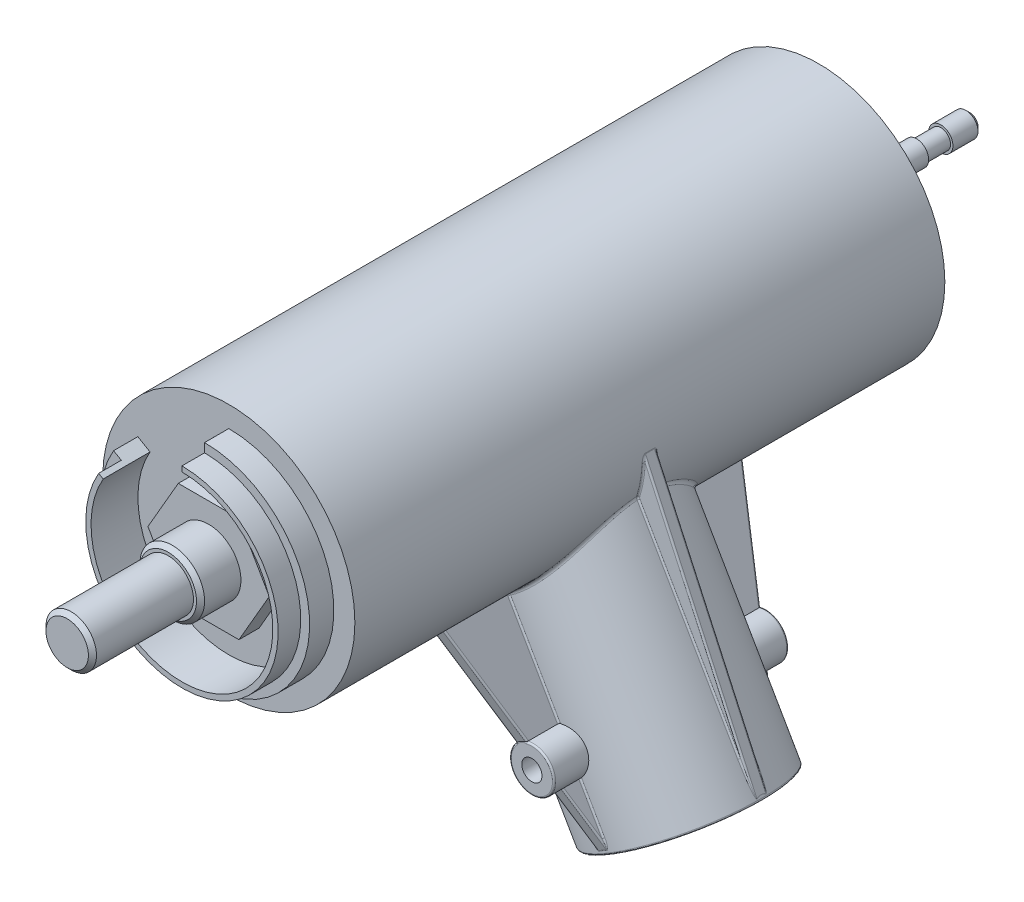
SolidWorks part; units mm, degrees
ref_plane "Plan de face" through (0, 0, 0) normal (0, 0, 1) x (1, 0, 0)
ref_plane "Plan de dessus" through (0, 0, 0) normal (0, 1, 0) x (1, 0, 0)
ref_plane "Plan de droite" through (0, 0, 0) normal (1, 0, 0) x (0, 0, -1)
sketch "Esquisse1" plane through (0, 0, 0) normal (0, 0, 1) x (1, 0, 0)
  circle A0 centre (0, 0) radius 15.6
  dimension "D1" = 31.2
extrude "Extrusion1" add sketch "Esquisse1" along normal mid plane 73
sketch "Esquisse2" plane through (0, 0, 0) normal (1, 0, 0) x (0, 0, -1)
  line L0 (-36.5, 11.25) -> (-36.5, 13)
  line L1 (-36.5, 13) -> (-39.5, 13)
  line L2 (-39.5, 13) -> (-39.5, 11.9)
  line L3 (-39.5, 11.9) -> (-42.3, 11.9)
  line L4 (-42.3, 11.9) -> (-42.3, 11.25)
  line L5 (-42.3, 11.25) -> (-36.5, 11.25)
  line L6 (-36.5, 15.6) -> (-36.5, -15.6) construction
  dimension "D1" = 13
  dimension "D2" = 11.9
  dimension "D3" = 11.25
  dimension "D4" = 5.8
  dimension "D5" = 3
revolve "Révolution1" add sketch "Esquisse2" angle 300 about axis through (0, 0, 36.5) along (0, 0, -1)
ref_plane "Plan1" through (0, 0, 0) normal (0.866, 0.5, 0) x (0, 0, -1)
ref_plane "Plan2" through (0, 0, 0) normal (0.5, -0.866, 0) x (0.866, 0.5, 0)
sketch "Esquisse3" plane through (0, 0, 0) normal (0.5, -0.866, 0) x (0.866, 0.5, 0)
  circle A0 centre (0, 0) radius 10.5
  dimension "D1" = 21
extrude "Extrusion2" add sketch "Esquisse3" along normal blind 41
sketch "Esquisse4" plane through (0, 0, 0) normal (0.866, 0.5, 0) x (0, 0, -1)
  line L0 (-21.6649, -6.1379) -> (-10.5, -40.5)
  line L2 (-10.5, -15.6) -> (-10.5, -41) construction
  dimension "D1" = 18
  dimension "D2" = 0.5
rib "Nervure8" sketch "Esquisse4" sketch "Esquisse4" thickness 1.5 extrusion direction parallel to sketch draft on no parameters "D1"=1.5
mirror "Symétrie1" about plane through (0, 0, 0) normal (0, 0, 1) of "Nervure8"
sketch "Esquisse5" plane through (0, 0, 0) normal (0, 0, 1) x (1, 0, 0)
  line L0 (14.3867, 2.7963) -> (29.3433, -29.824)
  line L1 (29.5933, -30.257) -> (14.8619, -4.7416) construction
  dimension "D1" = 0.5
rib "Nervure9" sketch "Esquisse5" sketch "Esquisse5" thickness 1.5 extrusion direction parallel to sketch draft on no parameters "D1"=1.5
mirror "Symétrie2" about plane through (0, 0, 0) normal (0.866, 0.5, 0) of "Nervure9"
fillet "Congé1" radius 0.2 33 edges at (11.1567, -40.324, 0) (-7.9311, -13.4335, 0) (15.5993, 0.1518, 0) (29.3433, -29.824, 0) (7.8, -13.51, -18.5905) (20.25, -35.074, -10.5) (20.25, -35.074, 10.5) (7.8, -13.51, 18.5905) (-5.6831, -14.528, 0.75) (4.0167, -27.9035, 0.75) (1.6958, -26.9956, 0.75) (4.0167, -27.9035, -0.75) (-5.6831, -14.528, -0.75) (1.6958, -26.9956, -0.75) (22.531, -14.9664, -0.75) (15.4232, -2.3423, -0.75) (22.1568, -17.4304, -0.75) (15.4232, -2.3423, 0.75) (22.531, -14.9664, 0.75) (22.1568, -17.4304, 0.75) (13.3916, -24.6949, 10.4732) (7.1415, -13.8694, 14.5348) (13.3916, -24.6949, 14.5348) (13.3916, -24.6949, -14.5348) (7.1415, -13.8694, -14.5348) (13.3916, -24.6949, -10.4732) (29.5933, -30.257, 0) (14.6906, -23.9449, -14.5348) (14.6906, -23.9449, -10.4732) (8.4405, -13.1194, -14.5348) (14.6906, -23.9449, 10.4732) (14.6906, -23.9449, 14.5348) (8.4405, -13.1194, 14.5348)
sketch "Esquisse8" plane through (0, 0, 0) normal (0, 0, 1) x (1, 0, 0)
  line L0 (11.5799, -40.657) -> (29.4201, -30.357) construction
  line L1 (8.5352, -13.2834) -> (20.3332, -33.7181) construction
  circle A0 centre (15.5, -26.8468) radius 2.75
  dimension "D1" = 5.5
  dimension "D2" = 10
  dimension "D3" = 0.75
extrude "Extrusion8" add sketch "Esquisse8" along normal mid plane 29
fillet "Congé2" radius 0.2 2 edges at (18.25, -26.8468, 14.5) (18.25, -26.8468, -14.5)
sketch "Esquisse9" plane through (0, 0, -14.5) normal (0, 0, -1) x (-1, 0, 0)
  circle A0 centre (-15.5, -26.8468) radius 1.25
  dimension "D1" = 2.5
extrude "Enlèv. mat.-Extru.2" cut sketch "Esquisse9" against normal through all
sketch "Esquisse7" plane through (20.5, -35.507, 0) normal (0.5, -0.866, 0) x (0.866, 0.5, 0)
  circle A0 centre (0, 0) radius 8
  dimension "D1" = 16
extrude "Enlèv. mat.-Extru.1" cut sketch "Esquisse7" against normal blind 35
fillet "Congé3" radius 0.5 12 edges at (-3.3007, -15.2974, -0.8184) (7.1233, -13.9428, -10.5227) (7.1233, -13.9428, 10.5227) (-3.3007, -15.2974, 0.8184) (14.8983, -4.7902, 0.8184) (8.5131, -13.1403, 10.5227) (8.5131, -13.1403, -10.5227) (14.8983, -4.7902, -0.8184) (13.4668, -7.8744, 7.1111) (13.4539, -7.8964, -7.1351) (13.4668, -7.8744, 7.1111) (11.9093, -10.0761, -9.0784)
sketch "Esquisse10" plane through (0, 0, -36.5) normal (0, 0, -1) x (-1, 0, 0)
  circle A0 centre (0, 0) radius 14.2
  dimension "D1" = 28.4
extrude "Enlèv. mat.-Extru.3" cut sketch "Esquisse10" against normal blind 5.3
sketch "Esquisse11" plane through (0, 0, -31.2) normal (0, 0, -1) x (-1, 0, 0)
  circle A0 centre (0, 0) radius 12.5
  dimension "D1" = 25
extrude "Enlèv. mat.-Extru.4" cut sketch "Esquisse11" against normal blind 1
sketch "Esquisse12" plane through (0, 0, -30.2) normal (0, 0, -1) x (-1, 0, 0)
  circle A0 centre (0, 0) radius 3
  circle A1 centre (0, 0) radius 1.5
  dimension "D1" = 6
  dimension "D2" = 3
extrude "Extrusion9" add sketch "Esquisse12" along normal blind 5
sketch "Esquisse14" plane through (0, 0, 0) normal (0, 1, 0) x (1, 0, 0)
  line L0 (1.5, 35.2) -> (-1.5, 35.2) construction
  line L1 (0, 35.2) -> (-1.5, 35.2)
  line L2 (0, 35.2) -> (0, 55.2)
  line L3 (0, 55.2) -> (-1, 55.2)
  line L4 (-1.5, 35.2) -> (-1.5, 48.6)
  line L5 (-1, 55.2) -> (-1.5, 54.7)
  line L6 (-1.5, 51.6) -> (-1.2, 51.6)
  line L7 (-1.2, 51.6) -> (-1.2, 48.6)
  line L8 (-1.2, 48.6) -> (-1.5, 48.6)
  line L9 (-1.5, 51.6) -> (-1.5, 54.7)
  point P1 (-1.5, 55.2)
  dimension "D1" = 20
  dimension "D2" = 1.5
  dimension "D3" = 1.2
  dimension "D4" = 3.6
  dimension "D6" = 3
revolve "Révolution2" add sketch "Esquisse14" angle 360 about L2
sketch "Esquisse15" plane through (0, 0, 0) normal (0, 1, 0) x (1, 0, 0)
  line L0 (0, -36.5) -> (-4, -36.5)
  line L1 (-4, -36.5) -> (-4, -43.5)
  line L2 (-3.5, -44) -> (-3.125, -44)
  line L3 (-3.125, -44) -> (-3.125, -56)
  line L4 (-2.625, -56.5) -> (0, -56.5)
  line L5 (0, -56.5) -> (0, -36.5)
  line L6 (-11.25, -36.5) -> (11.25, -36.5) construction
  line L7 (0, 31.2) -> (0, 36.5) construction
  line L8 (-3.125, -56) -> (-2.625, -56.5)
  line L9 (-4, -43.5) -> (-3.5, -44)
  point P3 (-4, -44)
  point P5 (-3.125, -56.5)
  dimension "D1" = 3.125
  dimension "D2" = 20
  dimension "D3" = 4
  dimension "D4" = 12.5
revolve "Révolution3" add sketch "Esquisse15" angle 360 about L5
sketch "Esquisse16" plane through (0, 0, 36.5) normal (0, 0, 1) x (1, 0, 0)
  line L0 (24.8291, 0) -> (-24.8291, 0) construction
  line L1 (3.7528, 6.5) -> (-3.7528, 6.5)
  line L2 (-3.7528, 6.5) -> (-7.5056, 0)
  line L3 (-7.5056, 0) -> (-3.7528, -6.5)
  line L4 (-3.7528, -6.5) -> (3.7528, -6.5)
  line L5 (3.7528, -6.5) -> (7.5056, 0)
  line L6 (7.5056, 0) -> (3.7528, 6.5)
  circle A0 centre (0, 0) radius 6.5 construction
  dimension "D1" = 13
extrude "Extrusion10" add sketch "Esquisse16" along normal blind 2.5
